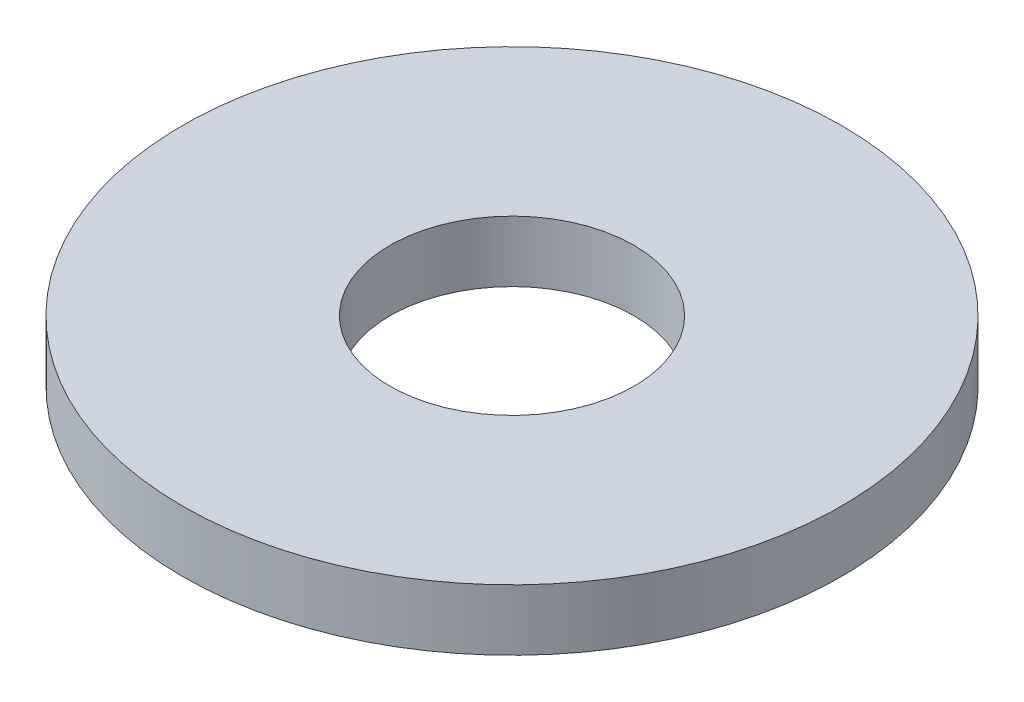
SolidWorks part; units mm, degrees
ref_plane "Plan de face" through (0, 0, 0) normal (0, 0, 1) x (1, 0, 0)
ref_plane "Plan de dessus" through (0, 0, 0) normal (0, 1, 0) x (1, 0, 0)
ref_plane "Plan de droite" through (0, 0, 0) normal (1, 0, 0) x (0, 0, -1)
sketch "Esquisse1" plane through (0, 0, 0) normal (0, 0, 1) x (1, 0, 0)
  line L0 (3, 1.5) -> (3, 0)
  line L1 (3, 0) -> (8.1, 0)
  line L2 (8.1, 0) -> (8.1, 1.5)
  line L3 (8.1, 1.5) -> (3, 1.5)
  line L4 (0, 1.5) -> (0, 0) construction
revolve "Révolution1" add sketch "Esquisse1" angle 360 about L4
